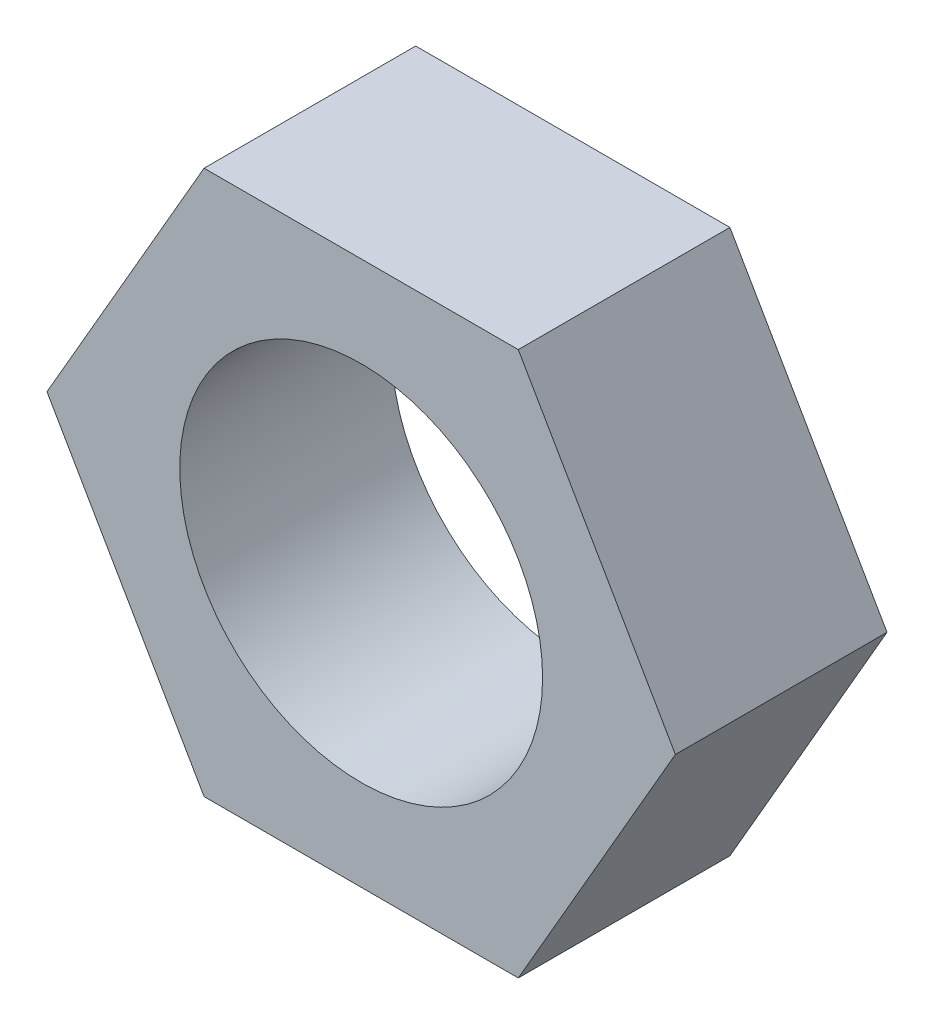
SolidWorks part; units mm, degrees
ref_plane "Front" through (0, 0, 0) normal (0, 0, 1) x (1, 0, 0)
ref_plane "Top" through (0, 0, 0) normal (0, 1, 0) x (1, 0, 0)
ref_plane "Right" through (0, 0, 0) normal (1, 0, 0) x (0, 0, -1)
sketch "Sketch1" plane through (0, 0, 0) normal (0, 0, 1) x (1, 0, 0)
  line L1 (4.1244, -7.1437) -> (8.2489, 0)
  line L2 (8.2489, 0) -> (4.1244, 7.1438)
  line L3 (4.1244, 7.1438) -> (-4.1244, 7.1438)
  line L4 (-4.1244, 7.1438) -> (-8.2489, 0)
  line L5 (-8.2489, 0) -> (-4.1244, -7.1437)
  line L6 (-4.1244, -7.1437) -> (4.1244, -7.1437)
  circle A0 centre (0, 0) radius 7.1438 construction
  circle A1 centre (0, 0) radius 4.7625
  dimension "D2" = 9.525
  dimension "D1" = 14.2875
extrude "Extrude1" add sketch "Sketch1" along normal blind 5.5562
